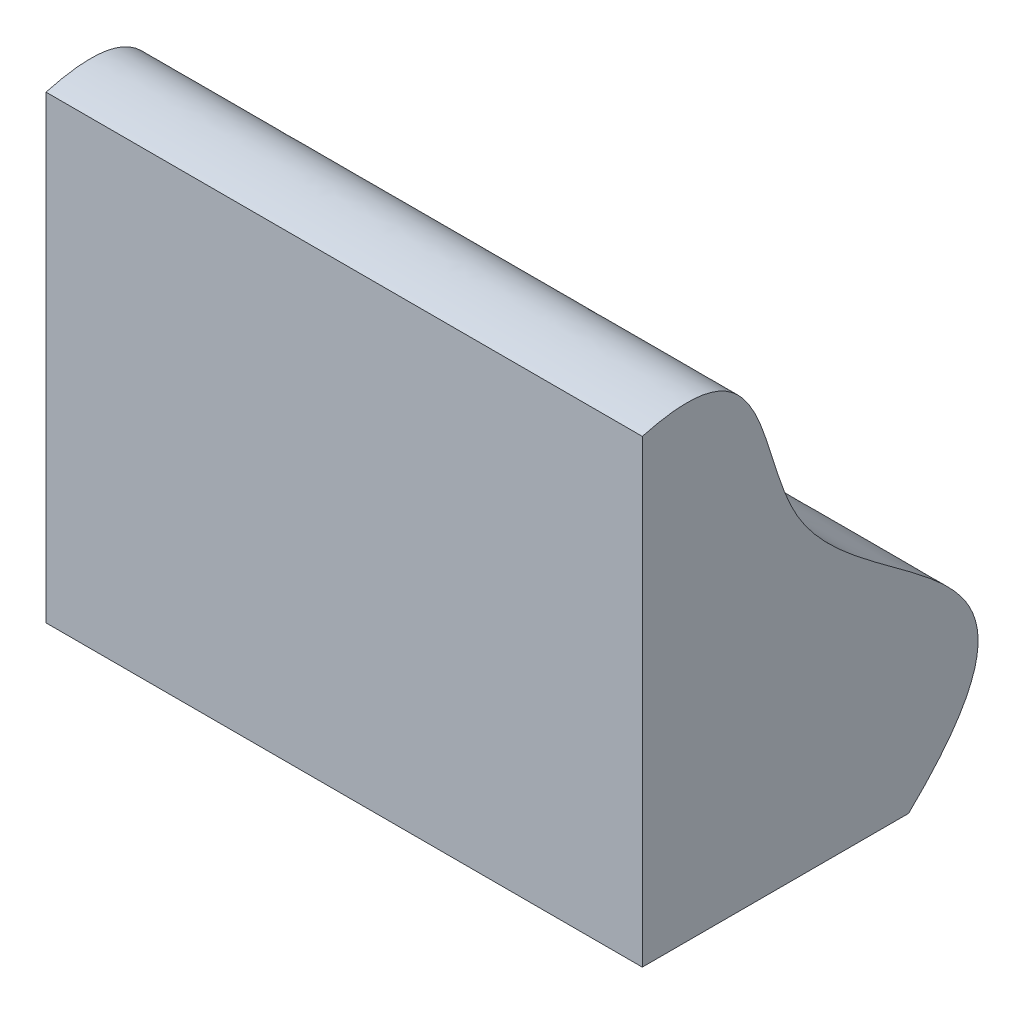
SolidWorks part; units mm, degrees
ref_plane "Front Plane" through (0, 0, 0) normal (0, 0, 1) x (1, 0, 0)
ref_plane "Top Plane" through (0, 0, 0) normal (0, 1, 0) x (1, 0, 0)
ref_plane "Right Plane" through (0, 0, 0) normal (1, 0, 0) x (0, 0, -1)
sketch "Sketch1" plane through (0, 0, 0) normal (1, 0, 0) x (0, 0, -1)
  line L0 (0, 0) -> (0, 69.3773)
  line L1 (0, 0) -> (40.1956, 0)
  spline S0 degree 3 poles (40.1956, 0) (67.6909, 26.4118) (12.9542, 31.2232) (19.6193, 74.6923) (0, 69.3773) knots 0 0 0 0 0.623022 1 1 1 1
extrude "Boss-Extrude1" add sketch "Sketch1" along normal mid plane 90
ref_plane "Plane1" through (0, 0, -150) normal (0, 0, 1) x (1, 0, 0)
sketch "Sketch2" plane through (0, 0, -150) normal (0, 0, 1) x (1, 0, 0)
  line L1 (30, 15) -> (-30, 15)
  line L2 (30, 15) -> (30, 45)
  line L3 (30, 45) -> (-30, 45)
  line L4 (-30, 15) -> (-30, 45)
  line L5 (30, 15) -> (-30, 45) construction
  line L6 (30, 45) -> (-30, 15) construction
  point P0 (0, 30)
  point P5 (0, 0)
  dimension "D1" = 60
  dimension "D2" = 30
  dimension "D3" = 30
